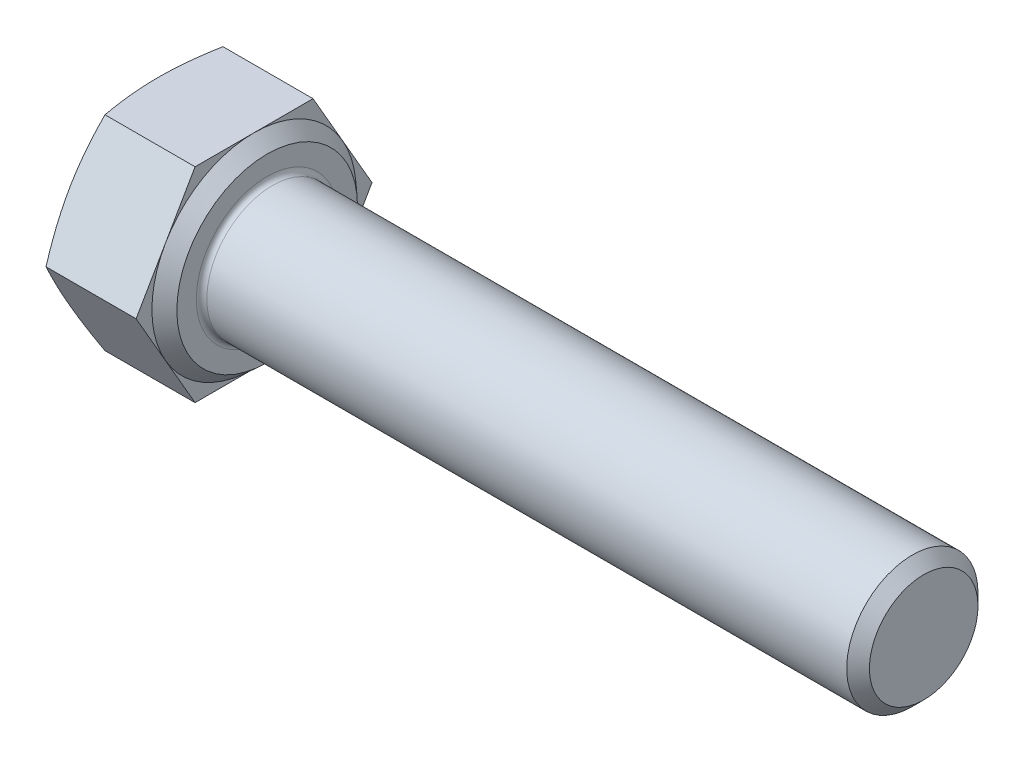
SolidWorks part; units mm, degrees
ref_plane "Front" through (0, 0, 0) normal (0, 0, 1) x (1, 0, 0)
ref_plane "Top" through (0, 0, 0) normal (0, 1, 0) x (1, 0, 0)
ref_plane "Right" through (0, 0, 0) normal (1, 0, 0) x (0, 0, -1)
sketch "Sketch-BaseHead" plane through (0, 0, 0) normal (1, 0, 0) x (0, 0, -1)
  line L1 (4.4918, 0) -> (2.2459, 3.89)
  line L2 (2.2459, 3.89) -> (-2.2459, 3.89)
  line L3 (-2.2459, 3.89) -> (-4.4918, 0)
  line L4 (-4.4918, 0) -> (-2.2459, -3.89)
  line L5 (-2.2459, -3.89) -> (2.2459, -3.89)
  line L6 (2.2459, -3.89) -> (4.4918, 0)
  circle A0 centre (0, 0) radius 3.89 construction
  dimension "s" = 7.78
extrude "BaseHead" add sketch "Sketch-BaseHead" along normal blind 3.65
sketch "Sketch4" plane through (-0.2646, 0, 5.9169) normal (0, 1, 0) x (0, 0, -1)
  line L0 (5.9169, 3.7369) -> (5.9169, -10.4477) construction
  line L2 (10.4087, -0.2646) -> (9.8069, -0.2646)
  line L4 (9.8069, -0.2646) -> (10.4087, -0.4837)
  line L6 (10.4087, -0.4837) -> (10.4087, -0.2646)
  dimension "D1" = 20
  dimension "D2" = 7.78
revolve "HeadChamfer" cut sketch "Sketch4" angle 360 about L0
sketch "Sketch1" plane through (0, 0, 0) normal (0, 0, 1) x (1, 0, 0)
  line L0 (3.65, 0) -> (4.15, 0)
  line L1 (4.15, 0) -> (4.15, -3.44)
  line L2 (4.15, -3.44) -> (3.65, -3.89)
  line L3 (3.65, -3.89) -> (3.65, 0) construction
  line L4 (0, 0) -> (7.5821, 0) construction
  line L5 (-4.0016, 0) -> (10.1831, 0) construction
  line L6 (3.65, -3.89) -> (0.219, -3.89) construction
  line L7 (3.65, 0) -> (3.65, -3.89)
  dimension "D1" = 3.89
  dimension "c" = 0.5
  dimension "D2" = 3.44
revolve "Revolve1" add sketch "Sketch1" angle 360 about axis through (-4.0016, 0, 0) along (1, 0, 0)
ref_plane "Plane2" through (13.15, 0, 0) normal (1, 0, 0) x (0, 0, -1)
sketch "Sketch3" plane through (4.15, 0, 0) normal (1, 0, 0) x (0, 0, -1)
  circle A0 centre (0, 0) radius 2.5
  dimension "d" = 5
extrude "BaseBody" add sketch "Sketch3" along normal blind 25
fillet "HeadFillet" radius 0.2 1 edges at (4.15, 0, -2.5)
chamfer "Chamfer1" distance 0.433 angle 45 1 edges at (29.15, 0, -2.5)
equation "\"D1@Sketch1\" = \"s@Sketch-BaseHead\"/ 2"
equation "\"D2@Sketch4\" = \"s@Sketch-BaseHead\""
equation "\"D1@Chamfer1\" =  ( \"d@Sketch3\" - \"D2@ThreadCosmetic1\" ) / 2 "
equation "\"b@ThreadCosmetic1\" = \"l@BaseBody\" - \"lg@Plane2\""
